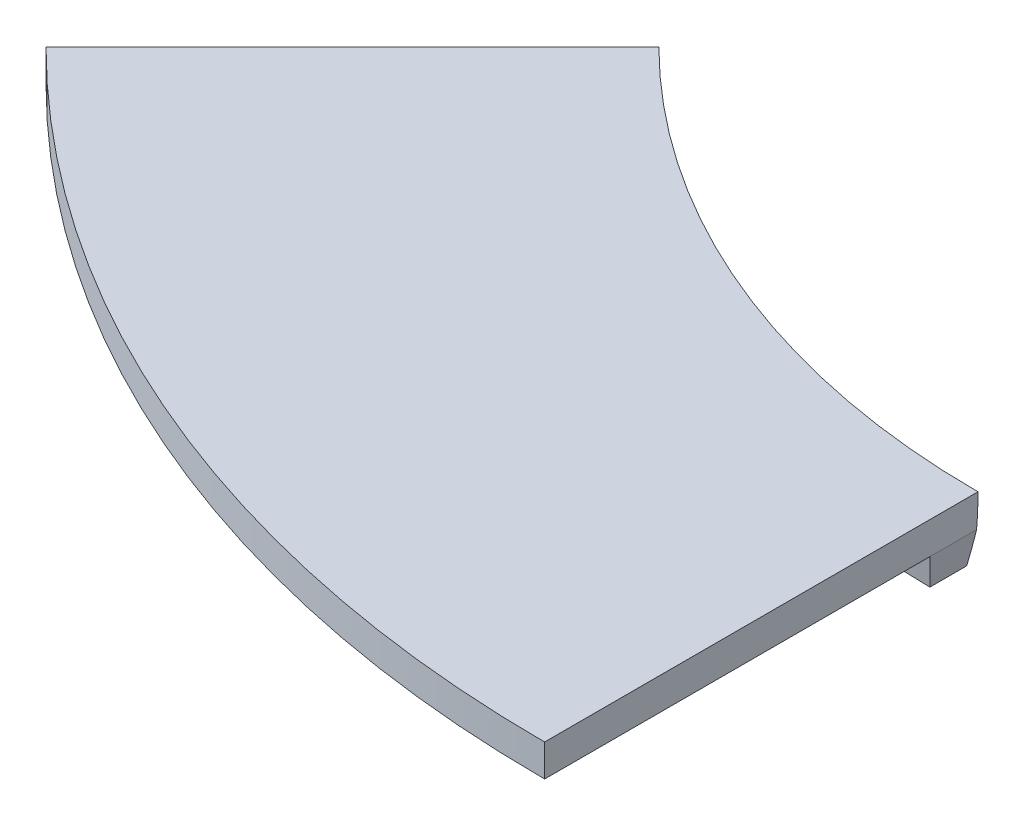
SolidWorks part; units mm, degrees
ref_plane "Front Plane" through (0, 0, 0) normal (0, 0, 1) x (1, 0, 0)
ref_plane "Top Plane" through (0, 0, 0) normal (0, 1, 0) x (1, 0, 0)
ref_plane "Right Plane" through (0, 0, 0) normal (1, 0, 0) x (0, 0, -1)
sketch "Sketch1" plane through (0, 0, 0) normal (0, 1, 0) x (1, 0, 0)
  line L0 (0, 0) -> (0, -3750)
  line L1 (0, 0) -> (-2651.6504, -2651.6504)
  arc A0 (-2651.6504, -2651.6504) -> (0, -3750) centre (0, 0) ccw
  arc A2 (-1697.0563, -1697.0563) -> (0, -2400) centre (0, 0) ccw
  dimension "D1" = 7500
  dimension "D2" = 4800
  dimension "D3" = 45
extrude "Boss-Extrude1" add sketch "Sketch1" along normal blind 100 contours A2 L1 A0 L0
sketch "Sketch2" plane through (0, 0, 0) normal (0, -1, 0) x (1, 0, 0)
  line L0 (0, 2550) -> (0, 2400)
  line L1 (0, 2400) -> (0, 3750) construction
  line L2 (-1803.1223, 1803.1223) -> (-1697.0563, 1697.0563)
  line L3 (-1697.0563, 1697.0563) -> (-2651.6504, 2651.6504) construction
  arc A0 (0, 2550) -> (-1803.1223, 1803.1223) centre (0, 0) ccw
  arc A1 (0, 2400) -> (-1697.0563, 1697.0563) centre (0, 0) ccw construction
  arc A2 (0, 2400) -> (-1697.0563, 1697.0563) centre (0, 0) ccw
extrude "Boss-Extrude2" add sketch "Sketch2" along normal blind 100 draft 10
fillet "Fillet1" radius 1140 1 edges at (-918.4402, 0, 2217.3109)
